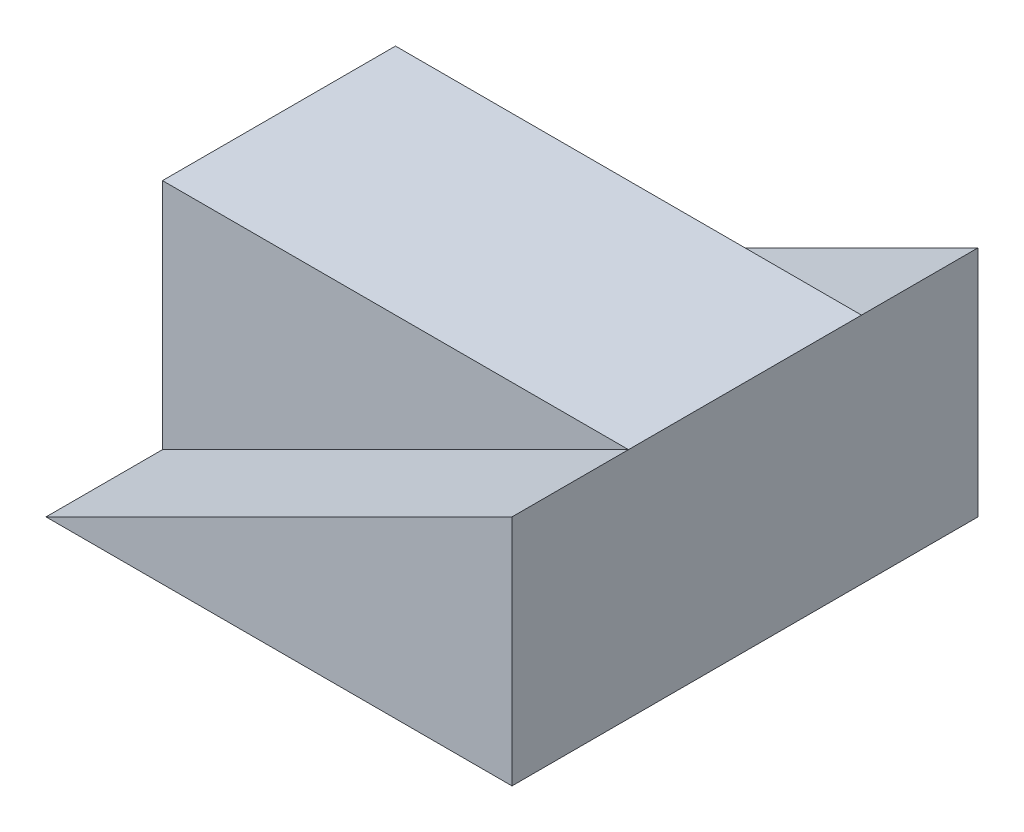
SolidWorks part; units mm, degrees
ref_plane "Front Plane" through (0, 0, 0) normal (0, 0, 1) x (1, 0, 0)
ref_plane "Top Plane" through (0, 0, 0) normal (0, 1, 0) x (1, 0, 0)
ref_plane "Right Plane" through (0, 0, 0) normal (1, 0, 0) x (0, 0, -1)
sketch "Sketch1" plane through (0, 0, 0) normal (0, 0, 1) x (1, 0, 0)
  line L0 (-50, 0) -> (50, 0) construction
  line L1 (-50, -25) -> (50, -25)
  line L2 (-50, -25) -> (-50, 25)
  line L3 (-50, 25) -> (50, 25)
  line L4 (50, -25) -> (50, 25)
  dimension "D1" = 100
  dimension "D2" = 50
extrude "Extrude1" add sketch "Sketch1" along normal mid plane 50
sketch "Sketch5" plane through (0, 0, 0) normal (0, 0, 1) x (1, 0, 0)
  line L0 (50, 25) -> (-50, -25)
  line L5 (-50, 25) -> (-50, -25)
  line L6 (-50, -25) -> (50, -25)
  line L7 (50, -25) -> (50, 25)
  line L8 (50, 25) -> (-50, 25)
  line L10 (-50, -25) -> (50, -25)
  line L11 (50, -25) -> (50, 25)
  dimension "D1" = 0
extrude "Extrude2" add sketch "Sketch5" along normal mid plane 100
